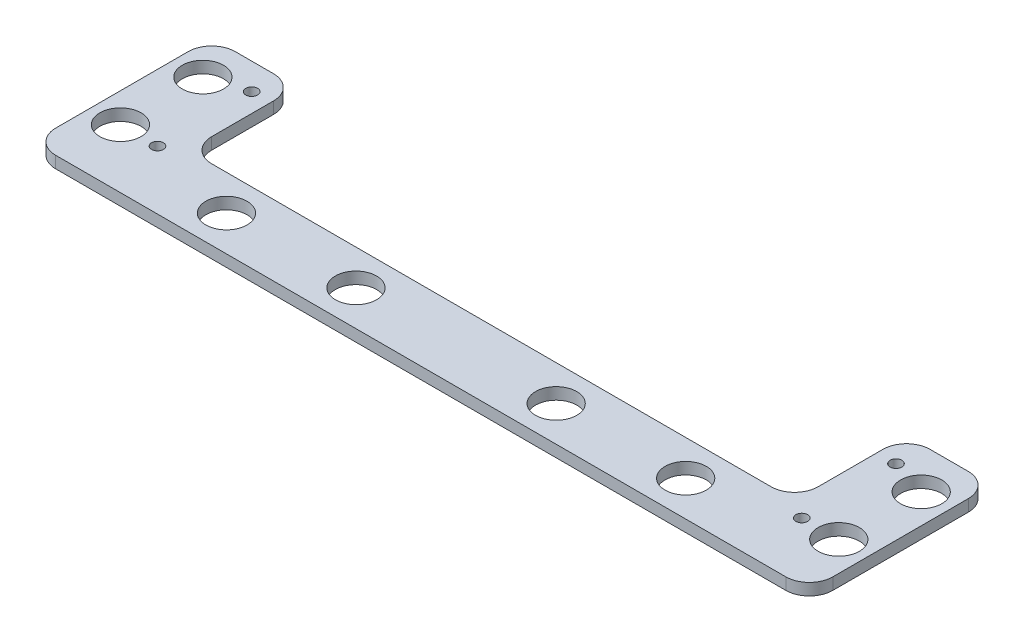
SolidWorks part; units mm, degrees
ref_plane "Front Plane" through (0, 0, 0) normal (0, 0, 1) x (1, 0, 0)
ref_plane "Top Plane" through (0, 0, 0) normal (0, 1, 0) x (1, 0, 0)
ref_plane "Right Plane" through (0, 0, 0) normal (1, 0, 0) x (0, 0, -1)
sketch "Sketch1" plane through (0, 0, 0) normal (0, 1, 0) x (1, 0, 0)
  line L0 (-787.4, -76.2) -> (787.4, -76.2)
  line L1 (838.2, -25.4) -> (838.2, 266.7)
  line L2 (787.4, 317.5) -> (704.85, 317.5)
  line L3 (654.05, 266.7) -> (654.05, 127)
  line L4 (603.25, 76.2) -> (-603.25, 76.2)
  line L5 (-654.05, 127) -> (-654.05, 260.35)
  line L6 (-704.85, 311.15) -> (-787.4, 311.15)
  line L7 (-838.2, 260.35) -> (-838.2, -25.4)
  line L8 (0, 912.5283) -> (0, -838.0484) construction
  arc A0 (704.85, 317.5) -> (654.05, 266.7) centre (704.85, 266.7) ccw
  arc A1 (838.2, 266.7) -> (787.4, 317.5) centre (787.4, 266.7) ccw
  arc A2 (838.2, -25.4) -> (787.4, -76.2) centre (787.4, -25.4) cw
  arc A3 (-838.2, -25.4) -> (-787.4, -76.2) centre (-787.4, -25.4) ccw
  arc A4 (-787.4, 311.15) -> (-838.2, 260.35) centre (-787.4, 260.35) ccw
  arc A5 (-654.05, 260.35) -> (-704.85, 311.15) centre (-704.85, 260.35) ccw
  arc A6 (-603.25, 76.2) -> (-654.05, 127) centre (-603.25, 127) cw
  arc A7 (603.25, 76.2) -> (654.05, 127) centre (603.25, 127) ccw
  circle A8 centre (774.7, 228.6) radius 44.45
  circle A9 centre (-774.7, 228.6) radius 44.45
  circle A10 centre (774.7, 50.8) radius 44.45
  circle A11 centre (-774.7, 50.8) radius 44.45
  circle A12 centre (495.3, 0) radius 44.45
  circle A13 centre (-495.3, 0) radius 44.45
  circle A14 centre (215.9, 0) radius 44.45
  circle A15 centre (-215.9, 0) radius 44.45
  point P11 (654.05, 317.5)
  point P14 (838.2, 317.5)
  point P17 (838.2, -76.2)
  point P20 (-838.2, -76.2)
  point P23 (-838.2, 311.15)
  point P26 (-654.05, 311.15)
  dimension "D9" = 50.8
  dimension "D10" = 50.8
  dimension "D11" = 88.9
  dimension "D12" = 63.5
  dimension "D1" = 1676.4
  dimension "D2" = 838.2
  dimension "D3" = 184.15
  dimension "D4" = 184.15
  dimension "D5" = 152.4
  dimension "D6" = 393.7
  dimension "D7" = 387.35
  dimension "D8" = 76.2
  dimension "D13" = 127
  dimension "D14" = 177.8
  dimension "D15" = 279.4
  dimension "D16" = 279.4
  dimension "D18" = 76.2
extrude "Extrude1" add sketch "Sketch1" along normal mid plane 25.4
sketch "Sketch2" plane through (0, 12.7, 0) normal (0, 1, 0) x (-1, 0, 0)
  line L0 (787.4, 76.2) -> (-787.4, 76.2) construction
  circle A0 centre (694.8632, -50.8) radius 12.7
  circle A1 centre (694.8632, -254) radius 12.7
  dimension "D1" = 25.4
  dimension "D2" = 127
  dimension "D3" = 203.2
extrude "Cut-Extrude1" cut sketch "Sketch2" against normal through all
mirror "Mirror1" about plane through (0, 0, 0) normal (1, 0, 0) of "Cut-Extrude1"
